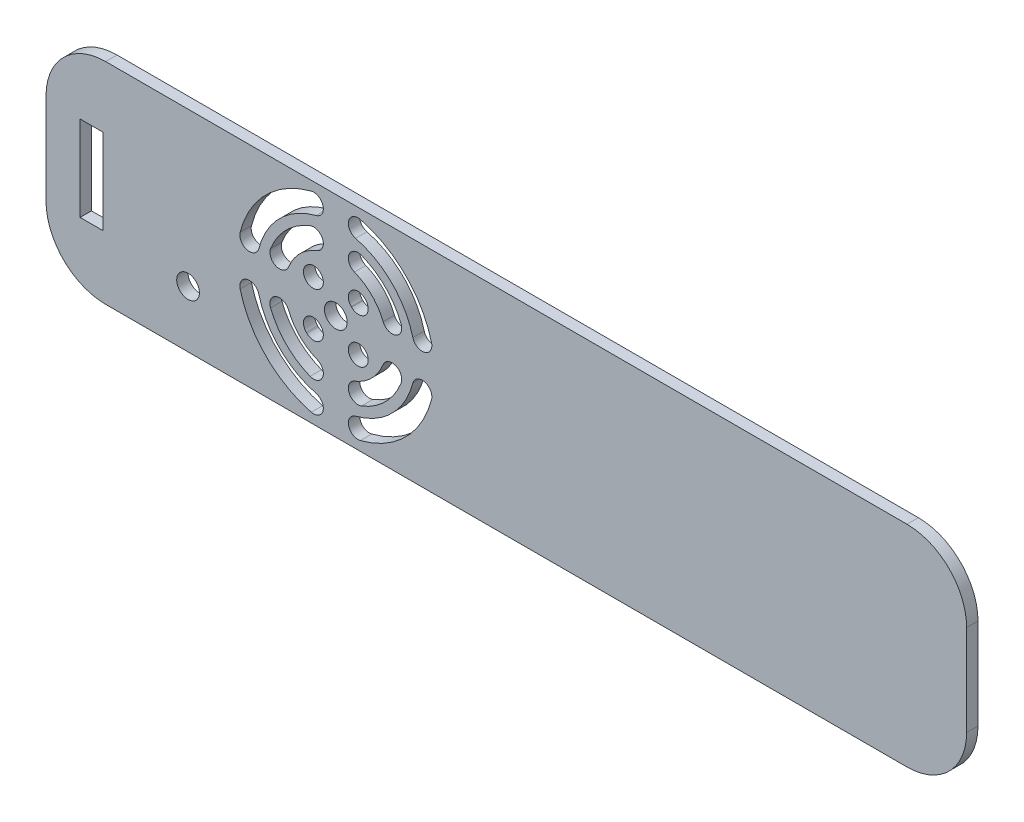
SolidWorks part; units mm, degrees
ref_plane "Спереди" through (0, 0, 0) normal (0, 0, 1) x (1, 0, 0)
ref_plane "Сверху" through (0, 0, 0) normal (0, 1, 0) x (1, 0, 0)
ref_plane "Справа" through (0, 0, 0) normal (1, 0, 0) x (0, 0, -1)
sketch "Эскиз1" plane through (0, 0, 0) normal (0, 0, 1) x (1, 0, 0)
  line L1 (-70.5, 18.5) -> (70.5, 18.5)
  line L2 (-81, 8) -> (-81, -8)
  line L3 (-70.5, -18.5) -> (70.5, -18.5)
  line L4 (81, 8) -> (81, -8)
  line L5 (-81, 18.5) -> (81, -18.5) construction
  line L6 (-81, -18.5) -> (81, 18.5) construction
  arc A2 (70.5, -18.5) -> (81, -8) centre (70.5, -8) ccw
  arc A3 (81, 8) -> (70.5, 18.5) centre (70.5, 8) ccw
  arc A4 (-81, -8) -> (-70.5, -18.5) centre (-70.5, -8) ccw
  arc A5 (-70.5, 18.5) -> (-81, 8) centre (-70.5, 8) ccw
  point P0 (0, 0)
  dimension "D3" = 10.5
  dimension "D1" = 162
  dimension "D2" = 37
extrude "Бобышка-Вытянуть1" add sketch "Эскиз1" along normal blind 2
sketch "Эскиз2" plane through (0, 0, 2) normal (0, 0, 1) x (1, 0, 0)
  line L0 (-81, 0) -> (81, 0) construction
  line L1 (81, -8) -> (81, 8) construction
  line L2 (-75, 7.5) -> (-71, 7.5)
  line L3 (-75, 7.5) -> (-75, -7.5)
  line L4 (-75, -7.5) -> (-71, -7.5)
  line L5 (-71, 7.5) -> (-71, -7.5)
  line L6 (-75, 7.5) -> (-71, -7.5) construction
  line L7 (-75, -7.5) -> (-71, 7.5) construction
  line L8 (-81, 8) -> (-81, -8) construction
  point P8 (-73, 0)
  dimension "D1" = 4
  dimension "D2" = 15
  dimension "D3" = 8
extrude "Вырез-Вытянуть1" cut sketch "Эскиз2" against normal through all
sketch "Эскиз3" plane through (0, 0, 2) normal (0, 0, 1) x (1, 0, 0)
  line L0 (0, 18.5) -> (0, -18.5) construction
  line L1 (70.5, 18.5) -> (-70.5, 18.5) construction
  line L2 (-70.5, -18.5) -> (70.5, -18.5) construction
  line L3 (-81, 0) -> (81, 0) construction
  line L4 (-81, 8) -> (-81, -8) construction
  line L5 (81, -8) -> (81, 8) construction
  line L6 (-30, 18.5) -> (-30, -18.5) construction
  line L7 (-30, 3.9) -> (0, 3.9) construction
  line L8 (-26.1, 18.5) -> (-26.1, 0) construction
  line L9 (-26.0497, 3.9503) -> (-18.9054, 11.0946) construction
  circle A0 centre (-30, 0) radius 18 construction
  arc A1 (-26, 3.9) -> (-26.1, 4) centre (-30, 0) ccw construction
  arc A2 (-20.1023, 3.9) -> (-26.1, 9.8977) centre (-30, 0) ccw construction
  arc A3 (-14.8023, 3.9) -> (-26.1, 15.1977) centre (-30, 0) ccw construction
  arc A16 (-13.1556, 4.3226) -> (-25.6774, 16.8444) centre (-30, 0) ccw
  arc A17 (-18.5206, 4.5232) -> (-25.4768, 11.4794) centre (-30, 0) ccw
  arc A18 (-24.7828, 5.0868) -> (-24.9132, 5.2172) centre (-30, 0) ccw
  arc A19 (-16.4489, 3.4774) -> (-26.5226, 13.5511) centre (-30, 0) ccw
  arc A20 (-21.6839, 3.2768) -> (-26.7232, 8.3161) centre (-30, 0) ccw
  arc A21 (-27.2172, 2.7132) -> (-27.2868, 2.7828) centre (-30, 0) ccw
  arc A22 (-25.6774, 16.8444) -> (-26.5226, 13.5511) centre (-26.1, 15.1977) ccw
  arc A23 (-25.4768, 11.4794) -> (-26.7232, 8.3161) centre (-26.1, 9.8977) ccw
  arc A24 (-24.9132, 5.2172) -> (-27.2868, 2.7828) centre (-26.1, 4) ccw
  arc A25 (-24.7828, 5.0868) -> (-27.2172, 2.7132) centre (-26, 3.9) cw
  arc A26 (-18.5206, 4.5232) -> (-21.6839, 3.2768) centre (-20.1023, 3.9) cw
  arc A27 (-13.1556, 4.3226) -> (-16.4489, 3.4774) centre (-14.8023, 3.9) cw
  arc A28 (-25.6774, -16.8444) -> (-13.1556, -4.3226) centre (-30, 0) ccw
  arc A29 (-26.5226, -13.5511) -> (-16.4489, -3.4774) centre (-30, 0) ccw
  arc A30 (-25.6774, -16.8444) -> (-26.5226, -13.5511) centre (-26.1, -15.1977) cw
  arc A31 (-13.1556, -4.3226) -> (-16.4489, -3.4774) centre (-14.8023, -3.9) ccw
  arc A32 (-25.4768, -11.4794) -> (-18.5206, -4.5232) centre (-30, 0) ccw
  arc A33 (-26.7232, -8.3161) -> (-21.6839, -3.2768) centre (-30, 0) ccw
  arc A34 (-18.5206, -4.5232) -> (-21.6839, -3.2768) centre (-20.1023, -3.9) ccw
  arc A35 (-25.4768, -11.4794) -> (-26.7232, -8.3161) centre (-26.1, -9.8977) cw
  arc A36 (-24.9132, -5.2172) -> (-24.7828, -5.0868) centre (-30, 0) ccw
  arc A37 (-24.7828, -5.0868) -> (-27.2172, -2.7132) centre (-26, -3.9) ccw
  arc A38 (-24.9132, -5.2172) -> (-27.2868, -2.7828) centre (-26.1, -4) cw
  arc A39 (-27.2868, -2.7828) -> (-27.2172, -2.7132) centre (-30, 0) ccw
  arc A40 (-46.8444, -4.3226) -> (-34.3226, -16.8444) centre (-30, 0) ccw
  arc A41 (-43.5511, -3.4774) -> (-33.4774, -13.5511) centre (-30, 0) ccw
  arc A42 (-46.8444, -4.3226) -> (-43.5511, -3.4774) centre (-45.1977, -3.9) cw
  arc A43 (-34.3226, -16.8444) -> (-33.4774, -13.5511) centre (-33.9, -15.1977) ccw
  arc A44 (-41.4794, -4.5232) -> (-34.5232, -11.4794) centre (-30, 0) ccw
  arc A45 (-38.3161, -3.2768) -> (-33.2768, -8.3161) centre (-30, 0) ccw
  arc A46 (-34.5232, -11.4794) -> (-33.2768, -8.3161) centre (-33.9, -9.8977) ccw
  arc A47 (-41.4794, -4.5232) -> (-38.3161, -3.2768) centre (-39.8977, -3.9) cw
  arc A48 (-35.2172, -5.0868) -> (-35.0868, -5.2172) centre (-30, 0) ccw
  arc A49 (-35.0868, -5.2172) -> (-32.7132, -2.7828) centre (-33.9, -4) ccw
  arc A50 (-35.2172, -5.0868) -> (-32.7828, -2.7132) centre (-34, -3.9) cw
  arc A51 (-32.7828, -2.7132) -> (-32.7132, -2.7828) centre (-30, 0) ccw
  arc A52 (-34.3226, 16.8444) -> (-46.8444, 4.3226) centre (-30, 0) ccw
  arc A53 (-33.4774, 13.5511) -> (-43.5511, 3.4774) centre (-30, 0) ccw
  arc A54 (-34.3226, 16.8444) -> (-33.4774, 13.5511) centre (-33.9, 15.1977) cw
  arc A55 (-46.8444, 4.3226) -> (-43.5511, 3.4774) centre (-45.1977, 3.9) ccw
  arc A56 (-34.5232, 11.4794) -> (-41.4794, 4.5232) centre (-30, 0) ccw
  arc A57 (-33.2768, 8.3161) -> (-38.3161, 3.2768) centre (-30, 0) ccw
  arc A58 (-41.4794, 4.5232) -> (-38.3161, 3.2768) centre (-39.8977, 3.9) ccw
  arc A59 (-34.5232, 11.4794) -> (-33.2768, 8.3161) centre (-33.9, 9.8977) cw
  arc A60 (-35.0868, 5.2172) -> (-35.2172, 5.0868) centre (-30, 0) ccw
  arc A61 (-35.2172, 5.0868) -> (-32.7828, 2.7132) centre (-34, 3.9) ccw
  arc A62 (-35.0868, 5.2172) -> (-32.7132, 2.7828) centre (-33.9, 4) cw
  arc A63 (-32.7132, 2.7828) -> (-32.7828, 2.7132) centre (-30, 0) ccw
  circle A64 centre (-30, 0) radius 2
  point P28 (-22.4775, 7.5225)
  point P110 (-30, 0)
extrude "Вырез-Вытянуть2" cut sketch "Эскиз3" against normal through all
sketch "Эскиз4" plane through (0, 0, 2) normal (0, 0, 1) x (1, 0, 0)
  line L0 (-81, 0) -> (81, 0) construction
  line L1 (-81, 8) -> (-81, -8) construction
  line L2 (81, -8) -> (81, 8) construction
  line L3 (-81, 0) -> (-81, -18.5) construction
  line L4 (-81, -18.5) -> (0, -18.5) construction
  line L5 (-70.5, -18.5) -> (70.5, -18.5) construction
  line L6 (-56, 18.5) -> (-56, -18.5) construction
  line L8 (70.5, 18.5) -> (-70.5, 18.5) construction
  circle A0 centre (-56, -8.5) radius 2
  dimension "D1" = 4
  dimension "D2" = 10
  dimension "D3" = 25
extrude "Вырез-Вытянуть3" cut sketch "Эскиз4" against normal through all
equation "\"D4@Эскиз3\"=\"D3@Эскиз3\""
